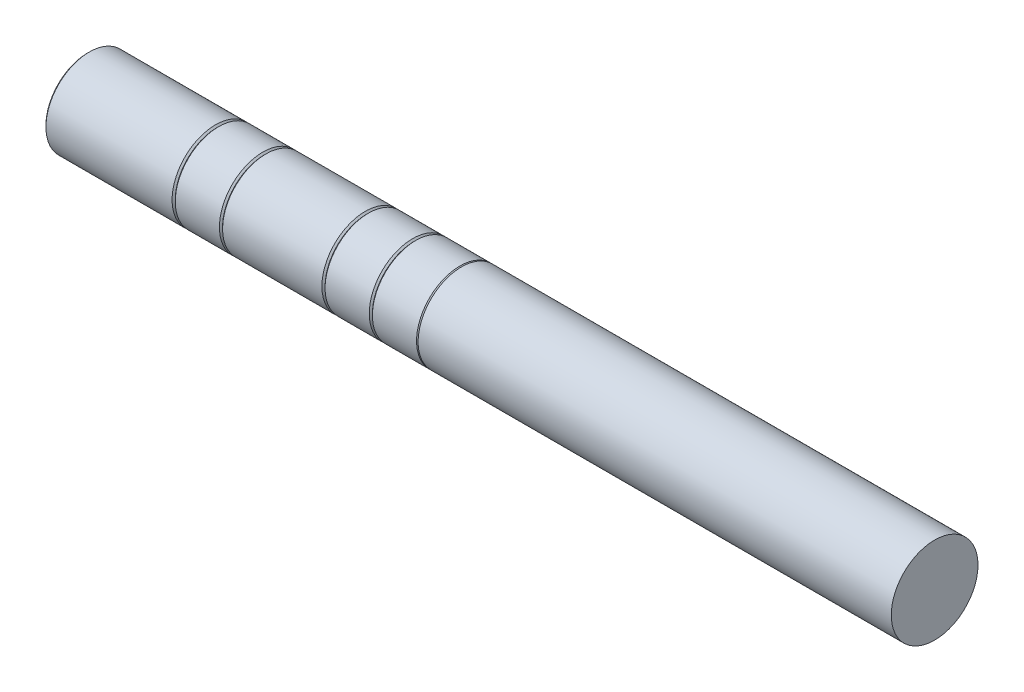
SolidWorks part; units mm, degrees
ref_plane "Спереди" through (0, 0, 0) normal (0, 0, 1) x (1, 0, 0)
ref_plane "Сверху" through (0, 0, 0) normal (0, 1, 0) x (1, 0, 0)
ref_plane "Справа" through (0, 0, 0) normal (1, 0, 0) x (0, 0, -1)
sketch "Эскиз1" plane through (0, 0, 0) normal (1, 0, 0) x (0, 0, -1)
  circle A0 centre (0, 0) radius 2.75
  dimension "D1" = 5.5
extrude "Бобышка-Вытянуть1" add sketch "Эскиз1" along normal blind 8.2
chamfer "Фаска1" distance 0.1 angle 45 1 edges at (8.2, 0, -2.75)
sketch "Эскиз2" plane through (8.2, 0, 0) normal (1, 0, 0) x (0, 0, -1)
  circle A0 centre (0, 0) radius 2.75
  dimension "D1" = 5.5
extrude "Бобышка-Вытянуть2" add sketch "Эскиз2" along normal blind 3
chamfer "Фаска2" distance 0.1 angle 45 2 edges at (8.2, 0, -2.75) (11.2, 0, -2.75)
sketch "Эскиз3" plane through (11.2, 0, 0) normal (1, 0, 0) x (0, 0, -1)
  circle A0 centre (0, 0) radius 2.75
  dimension "D1" = 5.5
extrude "Бобышка-Вытянуть3" add sketch "Эскиз3" along normal blind 6.5
chamfer "Фаска3" distance 0.1 angle 45 2 edges at (11.2, 0, -2.75) (17.7, 0, -2.75)
sketch "Эскиз4" plane through (17.7, 0, 0) normal (1, 0, 0) x (0, 0, -1)
  circle A0 centre (0, 0) radius 2.75
  dimension "D1" = 5.5
extrude "Бобышка-Вытянуть4" add sketch "Эскиз4" along normal blind 3
chamfer "Фаска4" distance 0.1 angle 45 2 edges at (17.7, 0, -2.75) (20.7, 0, -2.75)
sketch "Эскиз5" plane through (20.7, 0, 0) normal (1, 0, 0) x (0, 0, -1)
  circle A0 centre (0, 0) radius 2.75
  dimension "D1" = 5.5
extrude "Бобышка-Вытянуть5" add sketch "Эскиз5" along normal blind 3
chamfer "Фаска5" distance 0.1 angle 45 2 edges at (20.7, 0, -2.75) (23.7, 0, -2.75)
sketch "Эскиз6" plane through (23.7, 0, 0) normal (1, 0, 0) x (0, 0, -1)
  circle A0 centre (0, 0) radius 2.75
  dimension "D1" = 5.5
extrude "Бобышка-Вытянуть6" add sketch "Эскиз6" along normal blind 30
chamfer "Фаска6" distance 0.1 angle 45 1 edges at (0, 0, -2.75)
